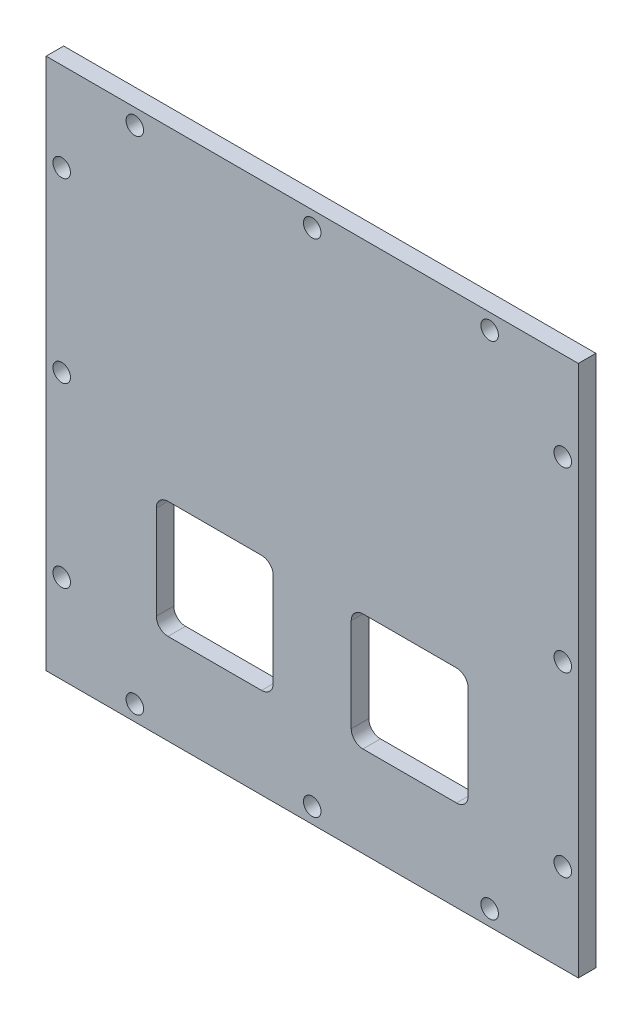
SolidWorks part; units mm, degrees
ref_plane "Front Plane" through (0, 0, 0) normal (0, 0, 1) x (1, 0, 0)
ref_plane "Top Plane" through (0, 0, 0) normal (0, 1, 0) x (1, 0, 0)
ref_plane "Right Plane" through (0, 0, 0) normal (1, 0, 0) x (0, 0, -1)
sketch "Sketch2" plane through (0, 0, 0) normal (0, 0, 1) x (1, 0, 0)
  line L1 (-68.25, 68.25) -> (68.25, 68.25)
  line L2 (-68.25, 68.25) -> (-68.25, -68.25)
  line L3 (-68.25, -68.25) -> (68.25, -68.25)
  line L4 (68.25, 68.25) -> (68.25, -68.25)
  point P4 (0, -68.25)
  point P6 (-68.25, 0)
  dimension "D1" = 136.5
  dimension "D2" = 136.5
extrude "Boss-Extrude1" add sketch "Sketch2" along normal blind 4.5
hole_wizard "M4 Clearance Hole1" positions "Sketch3" profile "Sketch5" hole size "M4" standard "ANSI Metric"
sketch "Sketch3" plane through (0, 0, 4.5) normal (0, 0, 1) x (1, 0, 0)
  line L1 (0, 0) -> (-94.137, 0) construction
  line L3 (0, 0) -> (0, 71.7866) construction
  line L5 (68.25, 68.25) -> (-68.25, 68.25) construction
  point P0 (-64.25, 45.5)
  point P2 (-64.25, 0)
  point P4 (-64.25, -45.5)
  point P23 (-45.5, 64.25)
  point P25 (0, 64.25)
  point P27 (45.5, 64.25)
  point P33 (64.25, -45.5)
  point P34 (64.25, 0)
  point P35 (64.25, 45.5)
  point P66 (45.5, -64.25)
  point P67 (0, -64.25)
  point P68 (-45.5, -64.25)
  dimension "D1" = 128.5
  dimension "D2" = 45.5
  dimension "D3" = 64.25
  dimension "D4" = 45.5
  dimension "D5" = 4
  dimension "D6" = 128.5
sketch "Sketch5" plane through (-64.25, 45.5, 4.5) normal (1, 0, 0) x (0, -1, 0)
  line L0 (0, 0) -> (0, 4.5)
  line L1 (0, 4.5) -> (2.25, 4.5)
  line L2 (2.25, 4.5) -> (2.25, 0)
  line L5 (2.25, 0) -> (0, 0)
  line L11 (0, -6.35) -> (0, 107.95) construction
  dimension "Thru Hole Dia." = 4.5
  dimension "Thru Hole Depth" = 4.5
sketch "Sketch8" plane through (0, 0, 4.5) normal (0, 0, 1) x (1, 0, 0)
  line L0 (0, 0) -> (0, 84.0982) construction
  line L1 (40, -18) -> (40, -42)
  line L2 (-37, -15) -> (-13, -15)
  line L3 (-40, -18) -> (-40, -42)
  line L4 (-37, -45) -> (-13, -45)
  line L5 (-10, -18) -> (-10, -42)
  line L6 (37, -15) -> (13, -15)
  line L7 (10, -18) -> (10, -42)
  line L8 (37, -45) -> (13, -45)
  line L9 (-68.25, -68.25) -> (68.25, -68.25) construction
  arc A0 (40, -18) -> (37, -15) centre (37, -18) ccw
  arc A1 (40, -42) -> (37, -45) centre (37, -42) cw
  arc A2 (10, -42) -> (13, -45) centre (13, -42) ccw
  arc A3 (13, -15) -> (10, -18) centre (13, -18) ccw
  arc A4 (-13, -15) -> (-10, -18) centre (-13, -18) cw
  arc A5 (-13, -45) -> (-10, -42) centre (-13, -42) ccw
  arc A6 (-40, -42) -> (-37, -45) centre (-37, -42) ccw
  arc A7 (-37, -15) -> (-40, -18) centre (-37, -18) ccw
  point P15 (40, -15)
  point P18 (40, -45)
  point P21 (10, -45)
  point P24 (10, -15)
  point P27 (-10, -15)
  point P30 (-10, -45)
  point P33 (-40, -45)
  point P36 (-40, -15)
  dimension "D5" = 3
  dimension "D1" = 23.25
  dimension "D2" = 30
  dimension "D3" = 30
  dimension "D4" = 20
extrude "Cut-Extrude1" cut sketch "Sketch8" against normal up to next
